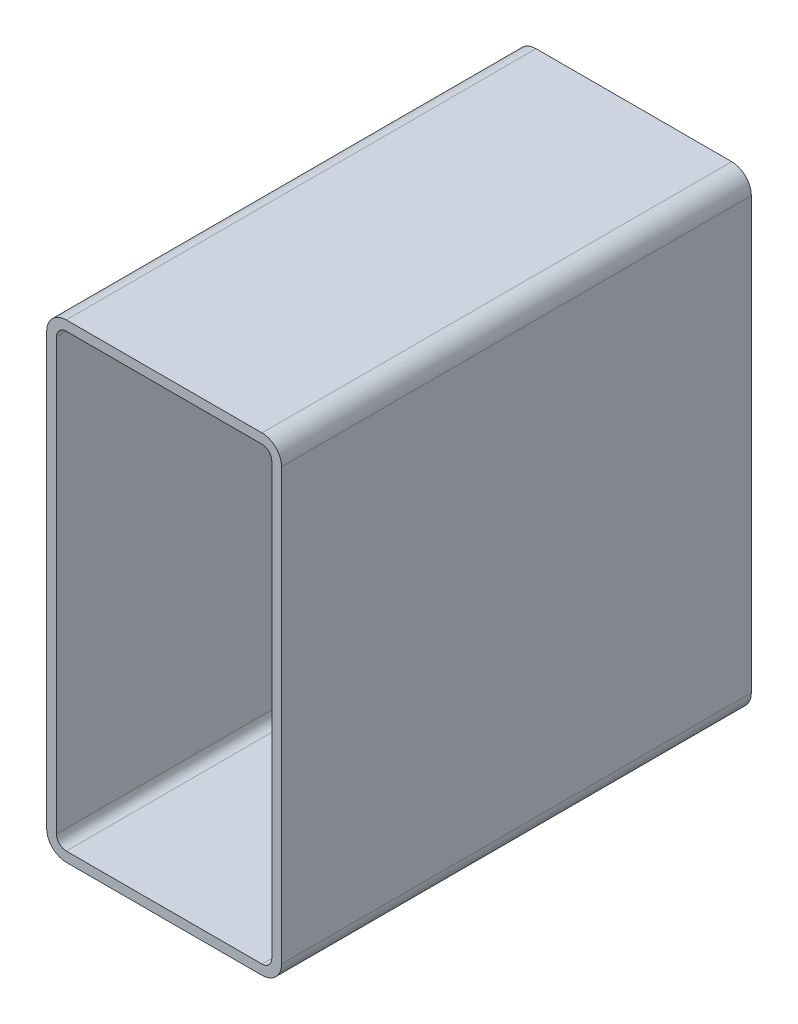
SolidWorks part; units mm, degrees
ref_plane "Front Plane" through (0, 0, 0) normal (0, 0, 1) x (1, 0, 0)
ref_plane "Top Plane" through (0, 0, 0) normal (0, 1, 0) x (1, 0, 0)
ref_plane "Right Plane" through (0, 0, 0) normal (1, 0, 0) x (0, 0, -1)
sketch "Sketch1" plane through (0, 0, 0) normal (0, 0, 1) x (1, 0, 0)
sketch_block_instance "HSS12x6x0.250-1"
sketch_block "HSS12x6x0.250"
extrude "Boss-Extrude1" add sketch "Sketch1" along normal blind 304.8
